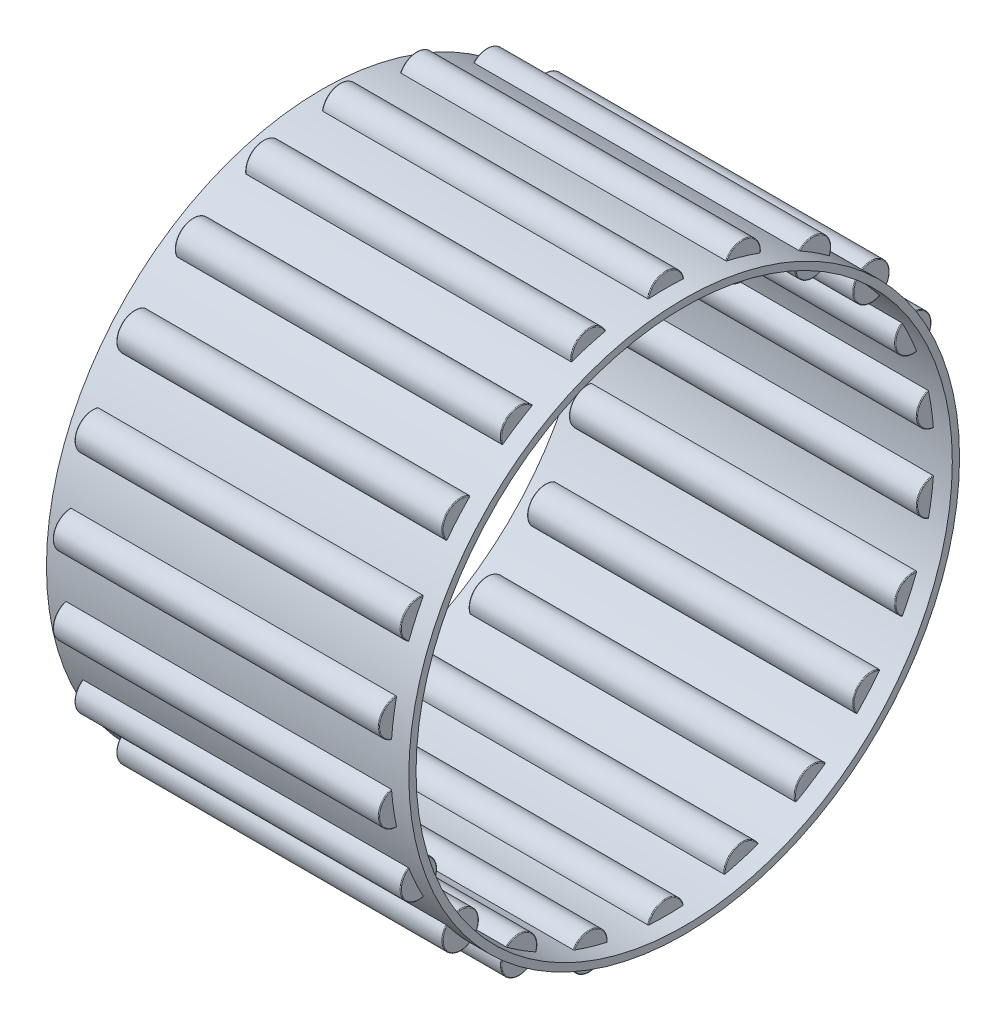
SolidWorks part; units mm, degrees
ref_plane "Plane1" through (0, 0, 0) normal (0, 0, 1) x (1, 0, 0)
ref_plane "Plane2" through (0, 0, 0) normal (0, 1, 0) x (1, 0, 0)
ref_plane "Plane3" through (0, 0, 0) normal (1, 0, 0) x (0, 0, -1)
sketch "Clipboard" plane through (0, 0, 0) normal (0, 0, 1) x (1, 0, 0)
  line L0 (-10, 0) -> (10, 0) construction
  line L1 (0, 0) -> (20.7325, -8.3765)
  line L2 (0, 0) -> (47.1009, 19.03)
  line L3 (0, 0) -> (23.8125, -9.6209)
  line L4 (0, 0) -> (-44.45, -1.5522)
  dimension "OD" = 50.8
  dimension "Count" = 22
  dimension "Show_count" = 22
  dimension "Max_count" = 22
  dimension "Min_count" = 2
  dimension "RollCLRad" = 23.8125
  dimension "Bore" = 44.45
sketch "CagSpiSke" plane through (0, 0, 0) normal (0, 0, 1) x (1, 0, 0)
  line L0 (15.875, 23.495) -> (15.875, 24.13)
  line L1 (15.875, 24.13) -> (-15.875, 24.13)
  line L2 (-15.875, 24.13) -> (-15.875, 23.495)
  line L3 (-15.875, 23.495) -> (15.875, 23.495)
  line L4 (-12.7, 0) -> (12.7, 0) construction
  dimension "cagRadius" = 23.495
  dimension "thickness" = 0.635
  dimension "Width" = 31.75
  dimension "halfWidth" = 15.875
revolve "CageSpine" add sketch "CagSpiSke" angle 360 about L4
sketch "RolDetSke" plane through (0, 0, 0) normal (0, 0, 1) x (1, 0, 0)
  line L0 (-17.78, 23.8125) -> (17.78, 23.8125) construction
  line L2 (-14.224, 25.4) -> (14.224, 25.4)
  line L3 (-14.2875, 25.3365) -> (-14.2875, 23.8125)
  line L5 (-14.2875, 23.8125) -> (14.2875, 23.8125)
  line L6 (14.2875, 25.3365) -> (14.2875, 23.8125)
  arc A0 (-14.224, 25.4) -> (-14.2875, 25.3365) centre (-14.224, 25.3365) ccw
  arc A1 (14.2875, 25.3365) -> (14.224, 25.4) centre (14.224, 25.3365) ccw
  dimension "radius" = 0.0635
  dimension "Roller_diameter" = 3.175
  dimension "Cyl_Len" = 28.575
  dimension "CLRad" = 23.8125
  dimension "halfCylLen" = 14.2875
revolve "RollerDetailed" add sketch "RolDetSke" angle 360 about L0
ref_axis "Axis1" through (-50, 0, 0) along (1, 0, 0)
pattern_circular "RollersDetailed" count 22 every 16.364 about axis through (-50, 0, 0) along (1, 0, 0) of "RollerDetailed"
sketch "RolSimSke" plane through (0, 0, 0) normal (0, 0, 1) x (1, 0, 0)
  line L0 (-17.78, 0) -> (17.78, 0) construction
  line L1 (-12.7, 0) -> (-38.1, 0) construction
  line L3 (-14.224, 25.4) -> (14.224, 25.4)
  line L4 (-14.2875, 25.3365) -> (-14.2875, 22.2885)
  line L5 (-14.224, 22.225) -> (14.224, 22.225)
  line L6 (14.2875, 25.3365) -> (14.2875, 22.2885)
  arc A0 (14.2875, 22.2885) -> (14.224, 22.225) centre (14.224, 22.2885) cw
  arc A1 (14.224, 25.4) -> (14.2875, 25.3365) centre (14.224, 25.3365) cw
  arc A2 (-14.2875, 25.3365) -> (-14.224, 25.4) centre (-14.224, 25.3365) cw
  arc A3 (-14.224, 22.225) -> (-14.2875, 22.2885) centre (-14.224, 22.2885) cw
  point P13 (14.2875, 25.4)
  point P16 (-14.2875, 25.4)
  point P19 (-14.2875, 22.225)
  dimension "radius" = 0.0635
  dimension "D1" = 14.2875
  dimension "Cyl_Len" = 28.575
  dimension "Bore" = 44.45
  dimension "Roller_diameter" = 3.175
revolve "RollersSimplified" [suppressed] add sketch "RolSimSke" angle 360 about L0
equation "\"RollCLRad@Clipboard\" = ( \"OD@Clipboard\" + \"Bore@Clipboard\" )  / 4"
equation "\"CLRad@RolDetSke\" = \"RollCLRad@Clipboard\""
equation "\"thickness@CagSpiSke\"  = ( \"OD@Clipboard\" - \"Bore@Clipboard\" )  / 10"
equation "\"cagRadius@CagSpiSke\" =  \"RollCLRad@Clipboard\" -  ( \"thickness@CagSpiSke\" / 2 ) "
equation "\"halfWidth@CagSpiSke\" = \"Width@CagSpiSke\" / 2"
equation "\"Bore@RolSimSke\" = \"Bore@Clipboard\""
equation "\"Roller_diameter@RolDetSke\" =  ( \"OD@Clipboard\" - \"Bore@Clipboard\" )  / 2"
equation "\"halfCylLen@RolDetSke\" = \"Cyl_Len@RolDetSke\" / 2"
equation "\"radius@RolDetSke\" = \"Roller_diameter@RolDetSke\" / 50"
equation "\"Cyl_Len@RolSimSke\" = \"Cyl_Len@RolDetSke\""
equation "\"D1@RolSimSke\" = \"Cyl_Len@RolSimSke\"/2"
equation "\"radius@RolSimSke\" = \"radius@RolDetSke\""
equation "\"Roller_diameter@RolSimSke\" =  ( \"OD@Clipboard\" - \"Bore@Clipboard\" )  / 2"
equation "\"Max_count@Clipboard\" = int( 3.14159265 / atn(( \"Roller_diameter@RolDetSke\" / 2) / sqr(\"RollCLRad@Clipboard\"  * \"RollCLRad@Clipboard\" - ( \"Roller_diameter@RolDetSke\" / 2) *  ( \"Roller_diameter@RolDetS"
equation "\"Max_count@Clipboard\" = ((sgn( \"Max_count@Clipboard\" - \"Count@Clipboard\" )-1)*( \"Max_count@Clipboard\" - \"Count@Clipboard\" ))/-2+ \"Count@Clipboard\""
equation "\"Count@RollersDetailed\" = int( \"Show_count@Clipboard\" ) "
equation "\"Count@RollersDetailed\" = ((sgn( \"Count@RollersDetailed\" - \"Max_count@Clipboard\" )-1)*( \"Count@RollersDetailed\" - \"Max_count@Clipboard\" ))/-2+ \"Max_count@Clipboard\""
equation "\"Count@RollersDetailed\" = ((sgn( \"Count@RollersDetailed\" - \"Min_count@Clipboard\" )+1)*( \"Count@RollersDetailed\" - \"Min_count@Clipboard\"))/2 +\"Min_count@Clipboard\""
equation "\"Angle@RollersDetailed\" = 360.0 / \"Max_count@Clipboard\""
